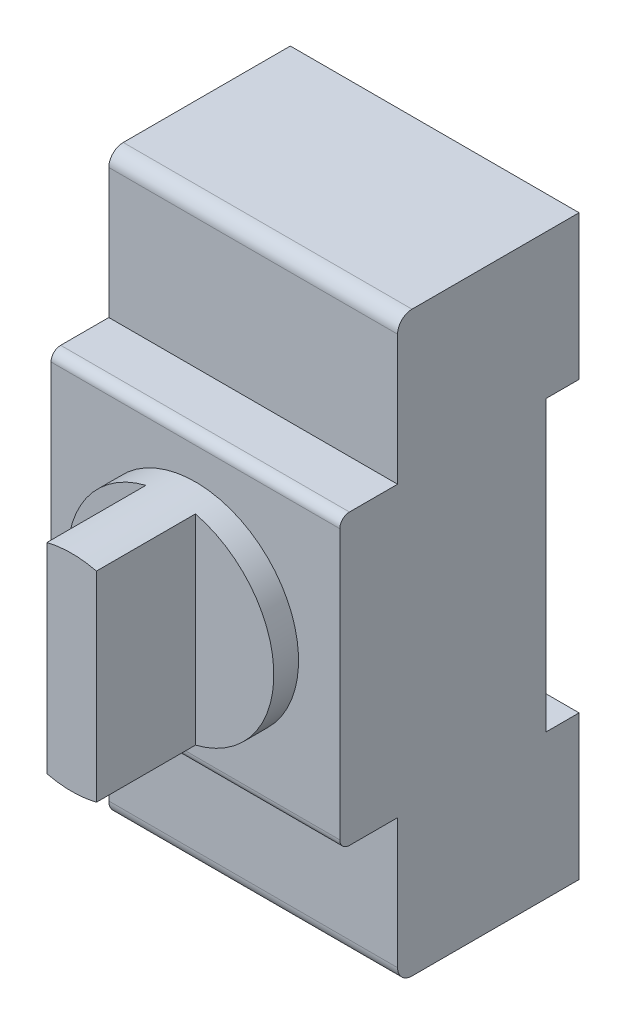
SolidWorks part; units mm, degrees
ref_plane "Plan de face" through (0, 0, 0) normal (0, 0, 1) x (1, 0, 0)
ref_plane "Plan de dessus" through (0, 0, 0) normal (0, 1, 0) x (1, 0, 0)
ref_plane "Plan de droite" through (0, 0, 0) normal (1, 0, 0) x (0, 0, -1)
ref_plane "Plan1" through (0, 0, 40) normal (0, 0, 1) x (1, 0, 0)
sketch "EW_SKETCH" plane through (0, 0, 0) normal (1, 0, 0) x (0, 0, -1)
  line L0 (0, 0) -> (4, 0)
  line L1 (4, 0) -> (4, 17.5)
  line L2 (4, 17.5) -> (-18, 17.5)
  line L3 (-18, 17.5) -> (-18, 0)
  line L4 (-18, 0) -> (-25, 0)
  line L5 (-25, 0) -> (-25, -35)
  line L6 (-25, -35) -> (-18, -35)
  line L7 (-18, -35) -> (-18, -52.5)
  line L8 (-18, -52.5) -> (4, -52.5)
  line L9 (4, -52.5) -> (4, -35)
  line L10 (4, -35) -> (0, -35)
  line L11 (0, -35) -> (0, 0)
  line L13 (-40, 13.75) -> (-40, -13.75) construction
extrude "EW_EXTRUDE" add sketch "EW_SKETCH" along normal blind 35
fillet "fillet1" radius 2.075 2 edges at (17.5, -52.5, 18) (17.5, 17.5, 18)
fillet "fillet2" radius 1.3833 2 edges at (17.5, -35, 25) (17.5, 0, 25)
sketch "Esquisse2" plane through (0, 0, 25) normal (0, 0, 1) x (1, 0, 0)
  line L0 (17.5, -52.5) -> (17.5, 17.5) construction
  line L1 (35, -52.5) -> (0, -52.5) construction
  line L2 (0, 17.5) -> (35, 17.5) construction
  circle A0 centre (17.5, -17.5) radius 12.5
  dimension "D1" = 25
extrude "Extrusion2" add sketch "Esquisse2" along normal up to surface (15 mm away)
sketch "Esquisse3" plane through (0, 0, 40) normal (0, 0, 1) x (1, 0, 0)
  line L0 (14.5, -17.5) -> (20.5, -17.5) construction
  line L1 (14.5, -2.0103) -> (5, -2.0103)
  line L2 (14.5, -2.0103) -> (14.5, -32.9897)
  line L3 (14.5, -32.9897) -> (5, -32.9897)
  line L4 (5, -2.0103) -> (5, -32.9897)
  line L5 (20.5, -2.0103) -> (30, -2.0103)
  line L6 (20.5, -2.0103) -> (20.5, -32.9897)
  line L7 (20.5, -32.9897) -> (30, -32.9897)
  line L8 (30, -2.0103) -> (30, -32.9897)
  circle A0 centre (17.5, -17.5) radius 12.5 construction
  point P10 (17.5, -17.5)
  dimension "D2" = 2.9897
  dimension "D1" = 6
extrude "Extrusion3" cut sketch "Esquisse3" against normal blind 12
equation "\"hoffset@EW_SKETCH\"=\"EW_HEIGHT@EW_SKETCH\"*0.5"
equation "\"d_rail@EW_SKETCH\"=4"
equation "\"rfillet1@fillet1\"=\"EW_HEIGHT@EW_SKETCH\"/40"
equation "\"rfillet2@fillet2\"=\"EW_HEIGHT@EW_SKETCH\"/60"
